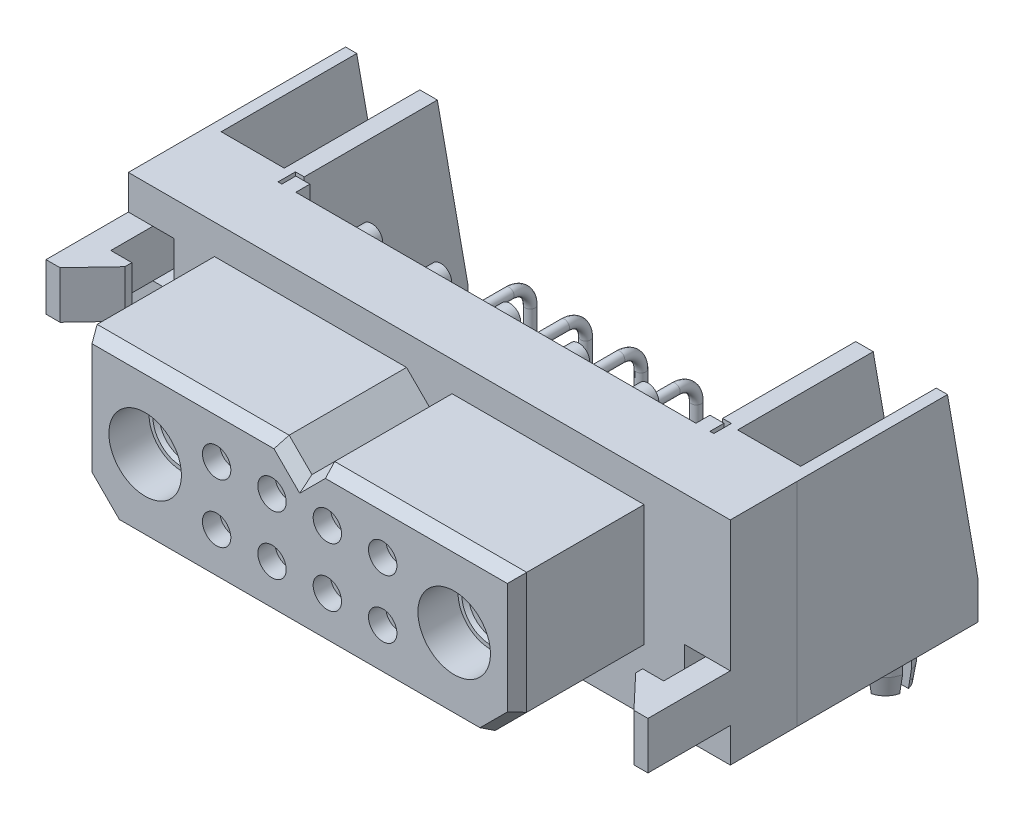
SolidWorks part; units mm, degrees
ref_plane "Front Plane" through (0, 0, 0) normal (0, 0, 1) x (1, 0, 0)
ref_plane "Top Plane" through (0, 0, 0) normal (0, 1, 0) x (1, 0, 0)
ref_plane "Right Plane" through (0, 0, 0) normal (1, 0, 0) x (0, 0, -1)
sketch "Sketch2" plane through (0, 0, 0) normal (0, 1, 0) x (1, 0, 0)
  line L0 (-21.8186, 0) -> (21.8186, 0)
  line L1 (21.8186, 0) -> (21.8186, 4.826)
  line L2 (21.8186, 4.826) -> (-15.5194, 4.826)
  line L5 (0, 0) -> (0, 49.1707) construction
  line L6 (-21.8186, 4.826) -> (-15.5194, 4.826)
  line L7 (-21.8186, 0) -> (-21.8186, 4.826)
  dimension "D1" = 43.6372
  dimension "D2" = 4.826
extrude "Extrude1" add sketch "Sketch2" along normal blind 15.3924
sketch "Sketch3" plane through (0, 0, 0) normal (0, 0, 1) x (1, 0, 0)
  line L0 (-13.2842, 2.159) -> (13.2842, 2.159)
  line L1 (-15.5702, 4.445) -> (-15.5702, 13.2334)
  line L2 (15.5702, 4.445) -> (15.5702, 13.2334)
  line L3 (-15.5702, 13.2334) -> (-1.651, 13.2334)
  line L4 (-21.8186, 15.3924) -> (-21.8186, 0) construction
  line L5 (-1.651, 13.2334) -> (0, 11.5824)
  line L6 (0, 11.5824) -> (1.651, 13.2334)
  line L7 (-15.5702, 4.445) -> (-13.2842, 2.159)
  line L8 (1.651, 13.2334) -> (15.5702, 13.2334)
  line L10 (0, 0) -> (0, 19.3392) construction
  line L12 (15.5702, 4.445) -> (13.2842, 2.159)
  point P0 (-21.8186, 7.6962)
  dimension "D1" = 15.5702
  dimension "D2" = 11.0744
  dimension "D4" = 5.5372
  dimension "D5" = 45
  dimension "D6" = 1.651
  dimension "D7" = 15.5702
  dimension "D8" = 2.286
extrude "Extrude2" add sketch "Sketch3" along normal blind 9.398
chamfer "Chamfer1" distance 0.889 angle 30 9 edges at (-14.4272, 3.302, 9.398) (0, 2.159, 9.398) (14.4272, 3.302, 9.398) (15.5702, 8.8392, 9.398) (8.6106, 13.2334, 9.398) (0.8255, 12.4079, 9.398) (-0.8255, 12.4079, 9.398) (-8.6106, 13.2334, 9.398) (-15.5702, 8.8392, 9.398)
sketch "Sketch4" plane through (0, 0, 0) normal (0, 0, 1) x (1, 0, 0)
  line L0 (-21.8186, 12.9032) -> (-18.5166, 12.9032)
  line L1 (-21.8186, 15.3924) -> (-21.8186, 0) construction
  line L2 (-18.5166, 12.9032) -> (-18.5166, 9.4742)
  line L3 (-18.5166, 9.4742) -> (-21.8186, 9.4742)
  line L4 (-21.8186, 12.9032) -> (-21.8186, 9.4742)
  line L5 (-21.8186, 7.6962) -> (22.8075, 7.6962) construction
  line L6 (-21.8186, 0) -> (21.8186, 0) construction
  line L7 (0, 0) -> (0, 17.824) construction
  line L12 (21.8186, 2.4892) -> (18.5166, 2.4892)
  line L13 (18.5166, 2.4892) -> (18.5166, 5.9182)
  line L14 (18.5166, 5.9182) -> (21.8186, 5.9182)
  line L15 (21.8186, 2.4892) -> (21.8186, 5.9182)
  dimension "D1" = 1.778
  dimension "D2" = 3.429
  dimension "D3" = 3.302
  dimension "D4" = 7.6962
extrude "Extrude3" add sketch "Sketch4" along normal blind 5.969
sketch "Sketch6" plane through (0, 12.9032, 0) normal (0, 1, 0) x (-1, 0, 0)
  line L0 (20.8026, 5.969) -> (18.5166, 3.556)
  line L1 (18.5166, 3.048) -> (20.0406, 3.048)
  line L2 (20.0406, 3.048) -> (20.0406, 0)
  line L3 (18.5166, 3.048) -> (18.5166, 0)
  line L4 (18.5166, 0) -> (21.8186, 0)
  line L5 (21.8186, 0) -> (21.8186, 5.969)
  line L6 (21.8186, 5.969) -> (18.5166, 5.969)
  line L7 (18.5166, 5.969) -> (18.5166, 0)
  line L8 (18.5166, 0) -> (20.0406, 0)
  line L9 (0, 0) -> (0, 15.3614) construction
  line L10 (20.8026, 5.969) -> (18.5166, 5.969)
  line L11 (18.5166, 5.969) -> (18.5166, 3.556)
  line L12 (-18.5166, 5.969) -> (-18.5166, 3.556)
  line L13 (-20.8026, 5.969) -> (-18.5166, 5.969)
  line L14 (-18.5166, 0) -> (-20.0406, 0)
  line L15 (-18.5166, 3.048) -> (-18.5166, 0)
  line L16 (-20.0406, 3.048) -> (-20.0406, 0)
  line L17 (-18.5166, 3.048) -> (-20.0406, 3.048)
  line L18 (-20.8026, 5.969) -> (-18.5166, 3.556)
  dimension "D2" = 1.016
  dimension "D3" = 1.524
  dimension "D4" = 0.508
  dimension "D5" = 3.048
  dimension "D1" = 0
extrude "Cut-Extrude1" cut sketch "Sketch6" against normal through all
sketch "Sketch7" plane through (0, 0, -4.826) normal (0, 0, -1) x (-1, 0, 0)
  line L0 (-20.0406, 2.4892) -> (-20.0406, 5.9182) construction
  line L1 (-18.5166, 2.4892) -> (-18.5166, 5.9182) construction
  line L2 (-20.0406, 2.4892) -> (-20.0406, 5.9182)
  line L3 (-18.5166, 2.4892) -> (-18.5166, 5.9182)
  line L4 (-18.5166, 2.4892) -> (-20.0406, 2.4892) construction
  line L5 (-20.0406, 5.9182) -> (-18.5166, 5.9182) construction
  line L6 (-18.5166, 2.4892) -> (-20.0406, 2.4892)
  line L7 (-20.0406, 5.9182) -> (-18.5166, 5.9182)
  line L8 (20.0406, 9.4742) -> (18.5166, 9.4742) construction
  line L9 (20.0406, 9.4742) -> (20.0406, 12.9032) construction
  line L10 (18.5166, 9.4742) -> (18.5166, 12.9032) construction
  line L11 (20.0406, 12.9032) -> (18.5166, 12.9032) construction
  line L12 (20.0406, 9.4742) -> (18.5166, 9.4742)
  line L13 (20.0406, 9.4742) -> (20.0406, 12.9032)
  line L14 (18.5166, 9.4742) -> (18.5166, 12.9032)
  line L15 (20.0406, 12.9032) -> (18.5166, 12.9032)
extrude "Cut-Extrude2" cut sketch "Sketch7" against normal blind 4.826
ref_plane "Plane1" through (0, 7.6962, 0) normal (0, 1, 0) x (-1, 0, 0)
sketch "Sketch8" plane through (0, 0, -4.826) normal (0, 0, -1) x (-1, 0, 0)
  line L0 (-15.5194, 15.3924) -> (-15.5194, 0)
  line L1 (-21.8186, 15.3924) -> (21.8186, 15.3924) construction
  line L2 (-21.8186, 0) -> (21.8186, 0) construction
  line L3 (-14.5034, 0) -> (-14.5034, 15.3924)
  line L4 (-14.5034, 15.3924) -> (-15.5194, 15.3924)
  line L5 (-15.5194, 0) -> (-14.5034, 0)
  line L6 (21.8186, 7.6962) -> (11.2459, 7.6962) construction
  line L7 (21.8186, 15.3924) -> (21.8186, 0) construction
  line L8 (0, 0) -> (0, -10.5152) construction
  line L9 (15.5194, 0) -> (14.5034, 0)
  line L10 (14.5034, 15.3924) -> (15.5194, 15.3924)
  line L11 (14.5034, 0) -> (14.5034, 15.3924)
  line L12 (15.5194, 15.3924) -> (15.5194, 0)
  circle A0 centre (-10.0076, 14.3764) radius 0.7874
  circle A1 centre (-5.0038, 14.3764) radius 0.7874
  circle A2 centre (0, 14.3764) radius 0.7874
  circle A3 centre (5.0038, 14.3764) radius 0.7874
  circle A4 centre (10.0076, 14.3764) radius 0.7874
  circle A5 centre (10.0076, 1.016) radius 0.7874
  circle A6 centre (5.0038, 1.016) radius 0.7874
  circle A7 centre (0, 1.016) radius 0.7874
  circle A8 centre (-5.0038, 1.016) radius 0.7874
  circle A9 centre (-10.0076, 1.016) radius 0.7874
  dimension "D3" = 1.5748
  dimension "D4" = 1.016
  dimension "D5" = 10.0076
  dimension "D1" = 1.016
  dimension "D2" = 15.5194
extrude "Extrude4" add sketch "Sketch8" along normal blind 1.016
sketch "Sketch9" plane through (0, 0, 9.398) normal (0, 0, 1) x (1, 0, 0)
  line L0 (-21.8186, 7.6962) -> (9.4559, 7.6962) construction
  line L1 (-21.8186, 9.4742) -> (-21.8186, 0) construction
  line L2 (6.0198, 21.5427) -> (6.0198, -4.9108) construction
  line L3 (6.0198, 9.8298) -> (2.0066, 9.8298) construction
  line L4 (6.0198, 9.8298) -> (6.0198, 5.588) construction
  circle A0 centre (6.0198, 9.8298) radius 1.0287
  circle A1 centre (2.0066, 9.8298) radius 1.0287
  circle A2 centre (-2.0066, 9.816) radius 1.0287
  circle A3 centre (-6.0198, 9.816) radius 1.0287
  circle A4 centre (6.0198, 5.588) radius 1.0287
  circle A5 centre (2.0066, 5.5742) radius 1.0287
  circle A6 centre (-2.0066, 5.5742) radius 1.0287
  circle A7 centre (-6.0198, 5.5742) radius 1.0287
  dimension "D1" = 2.0574
  dimension "D4" = 4.2418
  dimension "D5" = 2.0066
  dimension "D2" = 2.1336
  dimension "D3" = 6.0198
extrude "Cut-Extrude3" cut sketch "Sketch9" against normal blind 1.7272
ref_plane "Plane2" through (0, 9.8171, 0) normal (0, 1, 0) x (-1, 0, 0)
sketch "Sketch10" plane through (0, 9.8171, 0) normal (0, 1, 0) x (-1, 0, 0)
  line L0 (15.5702, 8.509) -> (1.651, 8.509) construction
  line L1 (6.0198, 7.6708) -> (7.0104, 7.6708)
  line L2 (7.0104, 7.6708) -> (7.0104, 8.1788)
  line L3 (7.0104, 8.1788) -> (6.6602, 8.1788)
  line L4 (6.6602, 8.1788) -> (6.4398, 7.797)
  line L5 (6.4398, 7.797) -> (6.0198, 7.797)
  line L6 (6.0198, 7.797) -> (6.0198, 7.6708)
  line L10 (6.0198, 7.6708) -> (6.0198, 15.6662) construction
  dimension "D1" = 6.0198
  dimension "D3" = 0.508
  dimension "D4" = 0.9906
  dimension "D5" = 0.8382
  dimension "D6" = 30
  dimension "D7" = 0.1262
  dimension "D9" = 0.3502
sketch "Sketch11" plane through (0, 0, -4.826) normal (0, 0, -1) x (-1, 0, 0)
  line L0 (15.0457, 7.6962) -> (-15.0457, 7.6962) construction
  line L1 (6.0198, 9.8171) -> (2.0066, 9.8171) construction
  line L2 (6.0198, 9.8171) -> (6.0198, 5.5753) construction
  circle A0 centre (6.0198, 9.8171) radius 0.8953
  circle A1 centre (2.0066, 9.8171) radius 0.8954
  circle A2 centre (-2.0066, 9.8171) radius 0.8953
  circle A3 centre (-6.0198, 9.8171) radius 0.8953
  circle A6 centre (6.0198, 5.5753) radius 0.8954
  circle A7 centre (2.0066, 5.5753) radius 0.8953
  circle A8 centre (-2.0066, 5.5753) radius 0.8953
  circle A9 centre (-6.0198, 5.5753) radius 0.8953
  dimension "D1" = 1.7907
  dimension "D5" = 4.0132
  dimension "D6" = 4.2418
  dimension "D2" = 6.0198
  dimension "D3" = 2.1209
  dimension "D4" = 90
extrude "Cut-Extrude4" cut sketch "Sketch11" against normal blind 1.397
sketch "Sketch12" plane through (0, 9.8171, 0) normal (0, 1, 0) x (-1, 0, 0)
  line L0 (6.0198, -0.6191) -> (6.0198, -13.6316) construction
  line L1 (6.0198, -3.429) -> (6.9151, -3.429)
  line L2 (6.9151, -3.429) -> (6.9151, -3.8031)
  line L3 (6.9151, -3.8031) -> (6.3754, -4.2891)
  line L4 (-14.5034, -4.826) -> (14.5034, -4.826) construction
  line L5 (6.3754, -4.2891) -> (6.0198, -4.2891)
  line L9 (6.0198, -3.429) -> (6.0198, -4.2891)
  dimension "D1" = 6.0198
  dimension "D2" = 0.8953
  dimension "D4" = 48
  dimension "D5" = 0.3556
  dimension "D6" = 1.397
  dimension "D7" = 0.8601
revolve "Revolve2" add sketch "Sketch12" angle 360 about L0
pattern_linear "LPattern2" count 4 spacing 4.0132 along (1, 0, 0) count 2 spacing 4.2418 along (0, -1, 0) of "Revolve2"
revolve "Revolve3" add sketch "Sketch10" angle 360 about L10
sketch "Sketch14" plane through (0, 0, 8.1788) normal (0, 0, 1) x (1, 0, 0)
  line L0 (-6.9986, 9.9695) -> (-5.041, 9.9695)
  line L1 (-6.9986, 9.6647) -> (-5.041, 9.6647)
  arc A0 (-6.9986, 9.9695) -> (-6.9986, 9.6647) centre (-6.0198, 9.8171) ccw
  circle A1 centre (-6.0198, 9.8171) radius 0.9906
  arc A2 (-5.041, 9.6647) -> (-5.041, 9.9695) centre (-6.0198, 9.8171) ccw
  dimension "D2" = 0.1524
  dimension "D3" = 0.3048
  dimension "D1" = 0
extrude "Cut-Extrude6" cut sketch "Sketch14" against normal blind 0.381
pattern_linear "LPattern3" count 4 spacing 4.0132 along (1, 0, 0) count 2 spacing 4.2418 along (0, -1, 0) of "Revolve3", "Cut-Extrude6"
sketch "Sketch15" plane through (0, 0, 9.398) normal (0, 0, 1) x (1, 0, 0)
  line L0 (-21.8186, 15.3924) -> (21.8186, 15.3924) construction
  line L1 (0, 0) -> (0, 18.1965) construction
  circle A0 centre (-11.2014, 7.6962) radius 2.6289
  circle A1 centre (11.2014, 7.6962) radius 2.6289
  dimension "D2" = 11.2014
  dimension "D3" = 5.2578
  dimension "D1" = 7.6962
extrude "Cut-Extrude7" cut sketch "Sketch15" against normal blind 2.9718
sketch "Sketch16" plane through (0, 7.6962, 0) normal (0, 1, 0) x (-1, 0, 0)
  line L1 (1.8636, 9.398) -> (15.0569, 9.398) construction
  line L2 (11.2014, 13.1763) -> (11.2014, -9.5504) construction
  line L3 (13.5636, 6.4262) -> (13.5636, 6.7564)
  line L4 (13.5636, 6.7564) -> (13.2842, 6.7564)
  line L5 (13.2842, 6.7564) -> (13.0429, 6.5151)
  line L6 (13.0429, 6.5151) -> (11.2014, 6.5151)
  line L7 (11.2014, 6.5151) -> (11.2014, 6.4262)
  line L9 (11.2014, 6.4262) -> (13.5636, 6.4262)
  dimension "D1" = 11.2014
  dimension "D2" = 2.3622
  dimension "D3" = 0.3302
  dimension "D4" = 2.0828
  dimension "D5" = 45
  dimension "D6" = 1.8415
  dimension "D7" = 2.8829
  dimension "D8" = 2.3622
revolve "Revolve4" add sketch "Sketch16" angle 360 about L7
mirror "Mirror1" about plane through (0, 0, 0) normal (1, 0, 0) of "Revolve4"
sketch "Sketch17" plane through (0, 15.3924, 0) normal (0, 1, 0) x (1, 0, 0)
  line L0 (21.8186, 4.826) -> (15.5194, 4.826) construction
  line L1 (21.8186, 4.826) -> (15.7988, 4.826)
  line L2 (21.8186, 4.826) -> (21.8186, 17.9578)
  line L3 (21.8186, 17.9578) -> (15.1638, 17.9578)
  line L4 (15.1638, 17.9578) -> (15.1638, 6.096)
  line L5 (15.1638, 6.096) -> (15.7988, 6.096)
  line L6 (15.7988, 6.096) -> (15.7988, 4.826)
  dimension "D1" = 15.1638
  dimension "D2" = 15.7988
  dimension "D3" = 6.6548
  dimension "D4" = 13.1318
  dimension "D5" = 1.27
extrude "Extrude5" add sketch "Sketch17" against normal blind 15.3924
sketch "Sketch18" plane through (0, 0, -17.9578) normal (0, 0, -1) x (-1, 0, 0)
  line L0 (-21.0058, 15.3924) -> (-21.0058, 2.7178)
  line L1 (-21.8186, 15.3924) -> (-15.1638, 15.3924) construction
  line L2 (-21.0058, 2.7178) -> (-16.4338, 2.7178)
  line L3 (-16.4338, 2.7178) -> (-16.4338, 15.3924)
  line L4 (-16.4338, 15.3924) -> (-21.0058, 15.3924)
  line L5 (-15.1638, 0) -> (-15.1638, 15.3924) construction
  line L6 (-21.8186, 0) -> (-21.8186, 15.3924) construction
  line L7 (-21.8186, 0) -> (-15.1638, 0) construction
  dimension "D1" = 1.27
  dimension "D2" = 0.8128
  dimension "D3" = 2.7178
extrude "Cut-Extrude8" cut sketch "Sketch18" against normal blind 12.0396
ref_plane "Plane3" through (18.7198, 0, 0) normal (1, 0, 0) x (0, 0, -1)
sketch "Sketch19" plane through (18.7198, 0, 0) normal (1, 0, 0) x (0, 0, -1)
  line L0 (5.9182, 2.7178) -> (5.9182, 15.3924) construction
  line L1 (5.9182, 7.6962) -> (5.9182, 9.7282)
  line L2 (2.5966, 7.6962) -> (9.1374, 7.6962) construction
  line L3 (4.826, 0) -> (17.9578, 0) construction
  line L4 (5.9182, 9.7282) -> (6.6802, 9.7282)
  line L5 (7.4422, 8.9662) -> (7.4422, 7.6962)
  line L6 (5.9182, 7.6962) -> (7.4422, 7.6962)
  arc A0 (7.4422, 8.9662) -> (6.6802, 9.7282) centre (6.6802, 8.9662) ccw
  dimension "D4" = 0.762
  dimension "D1" = 7.6962
  dimension "D2" = 1.524
  dimension "D3" = 2.032
revolve "Revolve5" add sketch "Sketch19" angle 360 about L6
sketch "Sketch20" plane through (0, 0, -7.4422) normal (0, 0, -1) x (-1, 0, 0)
  line L0 (-18.5048, 7.9113) -> (-18.5048, 8.4594)
  line L1 (-18.9348, 7.9113) -> (-19.483, 7.9113)
  line L2 (-18.5048, 6.933) -> (-18.9348, 6.933)
  line L3 (-18.5048, 6.933) -> (-18.5048, 7.4812)
  line L4 (-18.5048, 8.4594) -> (-18.9348, 8.4594)
  line L5 (-18.9348, 6.933) -> (-18.9348, 7.4812)
  line L6 (-19.483, 7.9113) -> (-19.483, 7.4812)
  line L7 (-17.9566, 7.9113) -> (-18.5048, 7.9113)
  line L8 (-18.9348, 7.9113) -> (-18.9348, 8.4594)
  line L9 (-17.9566, 7.9113) -> (-17.9566, 7.4812)
  line L10 (-17.9566, 7.4812) -> (-18.5048, 7.4812)
  line L11 (-18.9348, 7.4812) -> (-19.483, 7.4812)
extrude "Cut-Extrude9" cut sketch "Sketch20" against normal blind 0.508
sketch "Sketch22" plane through (0, 0, 0) normal (0, -1, 0) x (1, 0, 0)
  line L3 (21.8186, -4.826) -> (21.8186, -17.9578) construction
  line L4 (15.7988, -4.826) -> (21.8186, -4.826) construction
  circle A0 centre (18.7198, -14.351) radius 2.6924
  point P4 (18.8087, -4.826)
  dimension "D2" = 3.0988
  dimension "D1" = 5.3848
  dimension "D3" = 9.525
extrude "Cut-Extrude10" cut sketch "Sketch22" against normal blind 0.9398
sketch "Sketch23" plane through (18.7198, 0, 0) normal (1, 0, 0) x (0, 0, -1)
  line L1 (16.7259, 0.9398) -> (16.7259, 0)
  line L2 (11.6586, 0.9398) -> (17.0434, 0.9398) construction
  line L3 (4.826, 0) -> (17.9578, 0) construction
  line L4 (14.351, 4.3688) -> (14.351, -3.4036) construction
  line L5 (15.4305, 0.9398) -> (15.4305, 3.8608)
  line L6 (15.4305, 3.8608) -> (14.9225, 4.3688)
  line L7 (14.9225, 4.3688) -> (14.351, 4.3688)
  line L8 (16.7259, 0) -> (15.8623, 0)
  line L9 (15.8623, 0) -> (15.8623, -0.762)
  line L10 (15.8623, -0.762) -> (15.9385, -0.762)
  line L11 (15.9385, -0.762) -> (15.9385, -2.1082)
  line L12 (15.9385, -2.1082) -> (15.7353, -3.4036)
  line L13 (15.7353, -3.4036) -> (14.351, -3.4036)
  line L14 (15.4305, 0.9398) -> (16.7259, 0.9398)
  line L15 (14.351, 4.3688) -> (14.351, -3.4036)
  dimension "D1" = 1.0795
  dimension "D2" = 2.6924
  dimension "D3" = 0.9398
  dimension "D4" = 45
  dimension "D5" = 0.508
  dimension "D6" = 0.9398
  dimension "D7" = 3.429
  dimension "D8" = 14.351
  dimension "D9" = 1.5113
  dimension "D10" = 1.5875
  dimension "D11" = 1.3843
  dimension "D12" = 0.762
  dimension "D13" = 2.1082
  dimension "D14" = 3.4036
  dimension "D15" = 2.3749
revolve "Revolve6" add sketch "Sketch23" angle 360 about L15
sketch "Sketch24" plane through (0, -3.4036, 0) normal (0, -1, 0) x (1, 0, 0)
  line L0 (17.1644, -14.0335) -> (18.4023, -14.0335)
  line L1 (17.1644, -14.6685) -> (18.4023, -14.6685)
  line L2 (18.4023, -12.7956) -> (18.4023, -14.0335)
  line L3 (19.0373, -12.7956) -> (19.0373, -14.0335)
  line L4 (19.0373, -14.0335) -> (20.2752, -14.0335)
  line L5 (19.0373, -14.6685) -> (19.0373, -15.9064)
  line L6 (18.4023, -14.6685) -> (18.4023, -15.9064)
  line L7 (19.0373, -14.6685) -> (20.2752, -14.6685)
  circle A0 centre (18.7198, -14.351) radius 1.5875 construction
  arc A1 (19.0373, -12.7956) -> (18.4023, -12.7956) centre (18.7198, -14.351) ccw
  arc A2 (20.2752, -14.6685) -> (20.2752, -14.0335) centre (18.7198, -14.351) ccw
  arc A3 (18.4023, -15.9064) -> (19.0373, -15.9064) centre (18.7198, -14.351) ccw
  arc A4 (17.1644, -14.0335) -> (17.1644, -14.6685) centre (18.7198, -14.351) ccw
  dimension "D1" = 0.3175
  dimension "D2" = 0.635
  dimension "D3" = 0.3175
  dimension "D4" = 0.635
extrude "Cut-Extrude11" cut sketch "Sketch24" against normal blind 3.4036
sketch "Sketch25" plane through (15.1638, 0, 0) normal (-1, 0, 0) x (0, 0, 1)
  line L0 (-15.748, 15.3924) -> (-17.9578, 2.7178)
  line L1 (-17.9578, 15.3924) -> (-6.096, 15.3924) construction
  line L2 (-17.9578, 2.7178) -> (-17.9578, 15.3924)
  line L3 (-17.9578, 15.3924) -> (-15.748, 15.3924)
  line L4 (-5.842, 0) -> (-5.842, 15.3924) construction
  dimension "D1" = 9.906
extrude "Cut-Extrude12" cut sketch "Sketch25" against normal through all
mirror "Mirror2" about plane through (0, 0, 0) normal (1, 0, 0) of "Extrude5", "Cut-Extrude8", "Revolve5", "Cut-Extrude9", "Cut-Extrude10", "Revolve6", "Cut-Extrude11", "Cut-Extrude12"
sketch "Sketch26" plane through (15.1638, 0, 0) normal (-1, 0, 0) x (0, 0, 1)
  line L0 (-4.826, 15.3924) -> (-4.826, 0) construction
  line L1 (-6.604, 0.508) -> (-15.9004, 0.508)
  line L2 (-6.604, 0.508) -> (-6.604, 2.032)
  line L3 (-6.604, 2.032) -> (-15.9004, 2.032)
  line L4 (-15.9004, 0.508) -> (-15.9004, 2.032)
  line L5 (-4.826, 0) -> (-17.9578, 0) construction
  line L6 (-4.826, 0) -> (-4.826, 15.3924) construction
  dimension "D1" = 1.778
  dimension "D2" = 1.524
  dimension "D3" = 0.508
  dimension "D4" = 11.0744
extrude "Extrude6" add sketch "Sketch26" along normal up to next
sketch "Sketch27" plane through (0, 0, -4.826) normal (0, 0, -1) x (-1, 0, 0)
  line L0 (15.0457, 7.6962) -> (-15.0457, 7.6962) construction
  circle A0 centre (-11.2014, 7.6962) radius 3.175
  circle A1 centre (11.2014, 7.6962) radius 3.175
  dimension "D1" = 6.35
  dimension "D3" = 6.35
  dimension "D2" = 11.2014
  dimension "D4" = 11.2014
extrude "Cut-Extrude13" cut sketch "Sketch27" against normal blind 1.2192
ref_plane "Plane4" through (11.2014, 0, 0) normal (1, 0, 0) x (0, 0, -1)
sketch "Sketch28" plane through (0, 0, -3.6068) normal (0, 0, -1) x (-1, 0, 0)
  circle A0 centre (-11.2014, 7.6962) radius 2.7813
  dimension "D1" = 5.5626
extrude "Extrude7" add sketch "Sketch28" along normal blind 0.4572
sketch "Sketch29" plane through (0, 0, -4.064) normal (0, 0, -1) x (-1, 0, 0)
  line L0 (-11.2014, 10.5055) -> (-11.2014, -10.5055) construction
  line L1 (15.0457, 7.6962) -> (-15.0457, 7.6962) construction
  circle A0 centre (-11.2014, 7.6962) radius 1.5875
  dimension "D1" = 3.175
sketch "Sketch30" plane through (11.2014, 0, 0) normal (1, 0, 0) x (0, 0, -1)
  line L0 (4.064, 7.6962) -> (8.9408, 7.6962)
  line L1 (4.064, 6.1087) -> (4.064, 9.2837) construction
  line L2 (15.0457, 7.6962) -> (-15.0457, 7.6962) construction
  line L3 (11.2268, 5.4102) -> (11.2268, -3.7084)
  line L4 (4.826, 0) -> (17.9578, 0) construction
  line L5 (4.826, 0) -> (4.826, 15.3924) construction
  arc A0 (11.2268, 5.4102) -> (8.9408, 7.6962) centre (8.9408, 5.4102) ccw
  point P11 (11.2268, 7.6962)
  dimension "D3" = 2.286
  dimension "D1" = 6.4008
  dimension "D2" = 3.7084
sweep "Sweep1" add profiles "Sketch29" path "Sketch30"
chamfer "Chamfer2" distance 0.5588 angle 45 1 edges at (9.6139, -3.7084, -11.2268)
pattern_linear "LPattern4" count 2 spacing 22.4028 along (-1, 0, 0) of "Chamfer2", "Sweep1", "Extrude7"
sketch "Sketch31" plane through (0, 0, -4.2891) normal (0, 0, -1) x (-1, 0, 0)
  circle A1 centre (-6.0198, 5.5753) radius 0.3556
  circle A2 centre (-6.0198, 5.5753) radius 0.3556
  dimension "D1" = 0
ref_plane "Plane5" through (6.0198, 0, 0) normal (1, 0, 0) x (0, 0, -1)
sketch "Sketch32" plane through (6.0198, 0, 0) normal (1, 0, 0) x (0, 0, -1)
  line L0 (4.2891, 5.5753) -> (8.3312, 5.5753)
  line L1 (4.2891, 5.2197) -> (4.2891, 5.9309) construction
  line L2 (9.0932, 4.8133) -> (9.0932, -3.7084)
  line L3 (0, 0) -> (4.826, 0) construction
  line L4 (4.826, 0) -> (4.826, 15.3924) construction
  arc A0 (9.0932, 4.8133) -> (8.3312, 5.5753) centre (8.3312, 4.8133) ccw
  dimension "D3" = 0.762
  dimension "D1" = 3.7084
  dimension "D2" = 4.2672
sweep "Sweep2" add profiles "Sketch31" path "Sketch32"
chamfer "Chamfer3" distance 0.762 angle 15 1 edges at (5.6642, -3.7084, -9.0932)
sketch "Sketch33" plane through (0, 0, -4.2891) normal (0, 0, -1) x (-1, 0, 0)
  circle A1 centre (-6.0198, 9.8171) radius 0.3556
  circle A2 centre (-6.0198, 9.8171) radius 0.3556
  dimension "D1" = 0
sketch "Sketch34" plane through (6.0198, 0, 0) normal (1, 0, 0) x (0, 0, -1)
  line L0 (4.2891, 9.8171) -> (11.811, 9.8171)
  line L1 (4.2891, 9.4615) -> (4.2891, 10.1727) construction
  line L2 (15.0457, 9.8171) -> (-15.0457, 9.8171) construction
  line L3 (13.335, 8.2931) -> (13.335, -3.7084)
  line L4 (0, 0) -> (4.826, 0) construction
  line L5 (4.826, 15.3924) -> (4.826, 0) construction
  arc A0 (13.335, 8.2931) -> (11.811, 9.8171) centre (11.811, 8.2931) ccw
  point P13 (13.335, 9.8171)
  dimension "D3" = 1.524
  dimension "D1" = 3.7084
  dimension "D2" = 8.509
sweep "Sweep3" add profiles "Sketch33" path "Sketch34"
chamfer "Chamfer4" distance 0.762 angle 15 1 edges at (5.6642, -3.7084, -13.335)
pattern_linear "LPattern5" count 4 spacing 4.0132 along (-1, 0, 0) of "Chamfer4", "Sweep3", "Chamfer3", "Sweep2"
